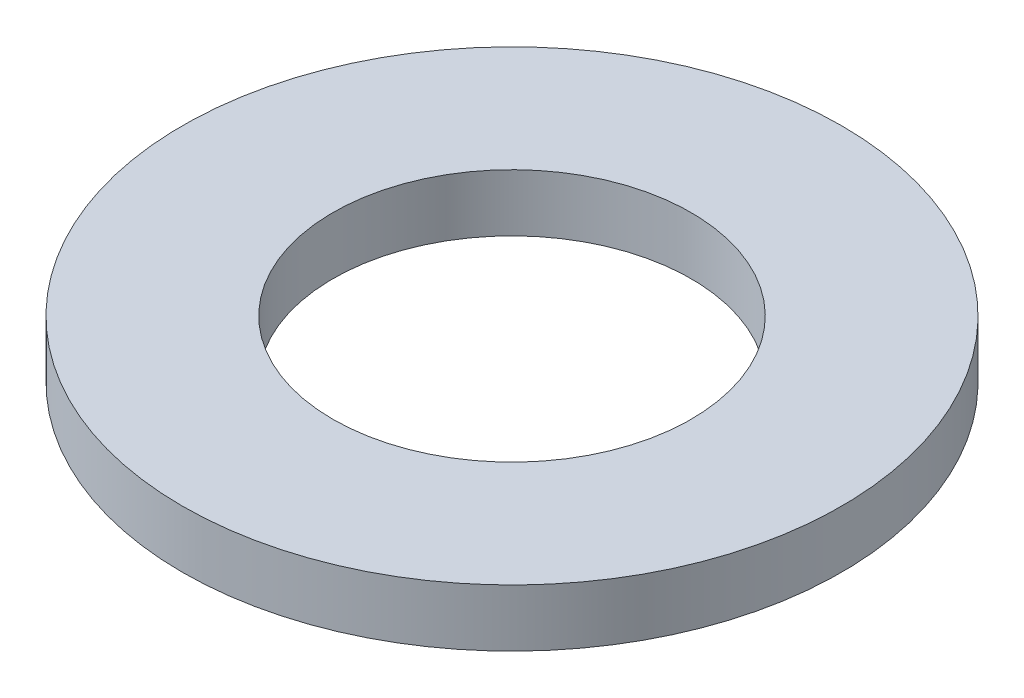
SolidWorks part; units mm, degrees
ref_plane "Front" through (0, 0, 0) normal (0, 0, 1) x (1, 0, 0)
ref_plane "Top" through (0, 0, 0) normal (0, 1, 0) x (1, 0, 0)
ref_plane "Right" through (0, 0, 0) normal (1, 0, 0) x (0, 0, -1)
sketch "Sketch1" plane through (0, 0, 0) normal (0, 1, 0) x (1, 0, 0)
  circle A0 centre (0, 0) radius 25
  circle A1 centre (0, 0) radius 46
extrude "Extrude1" add sketch "Sketch1" along normal blind 8
